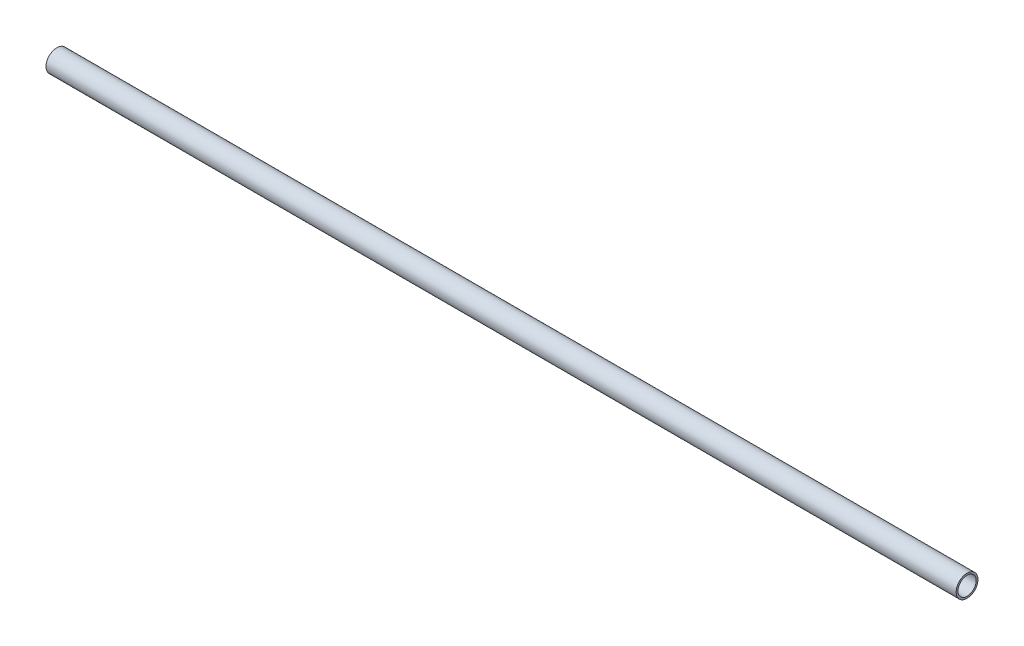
SolidWorks part; units mm, degrees
ref_plane "Front Plane" through (0, 0, 0) normal (0, 0, 1) x (1, 0, 0)
ref_plane "Top Plane" through (0, 0, 0) normal (0, 1, 0) x (1, 0, 0)
ref_plane "Right Plane" through (0, 0, 0) normal (1, 0, 0) x (0, 0, -1)
sketch "Sketch1" plane through (0, 0, 0) normal (1, 0, 0) x (0, 0, -1)
  circle A0 centre (0, 0) radius 100
  circle A1 centre (0, 0) radius 120
extrude "Extrude1" add sketch "Sketch1" along normal blind 10000
sketch "x = 45D" plane through (0, 0, 0) normal (0, 0, 1) x (1, 0, 0)
  line L2 (10000, 100) -> (0, 100) construction
  line L5 (9000, 0) -> (9000, 100)
sketch "x = 0 - 10 m (centerline)" plane through (0, 0, 0) normal (0, 0, 1) x (1, 0, 0)
  line L0 (0, 0) -> (10000, 0)
sketch "x = 0 - 10 m (wall)" plane through (0, 0, 0) normal (0, 0, 1) x (1, 0, 0)
  line L0 (0, 100) -> (10000, 100)
  line L1 (10000, 100) -> (0, 100) construction
